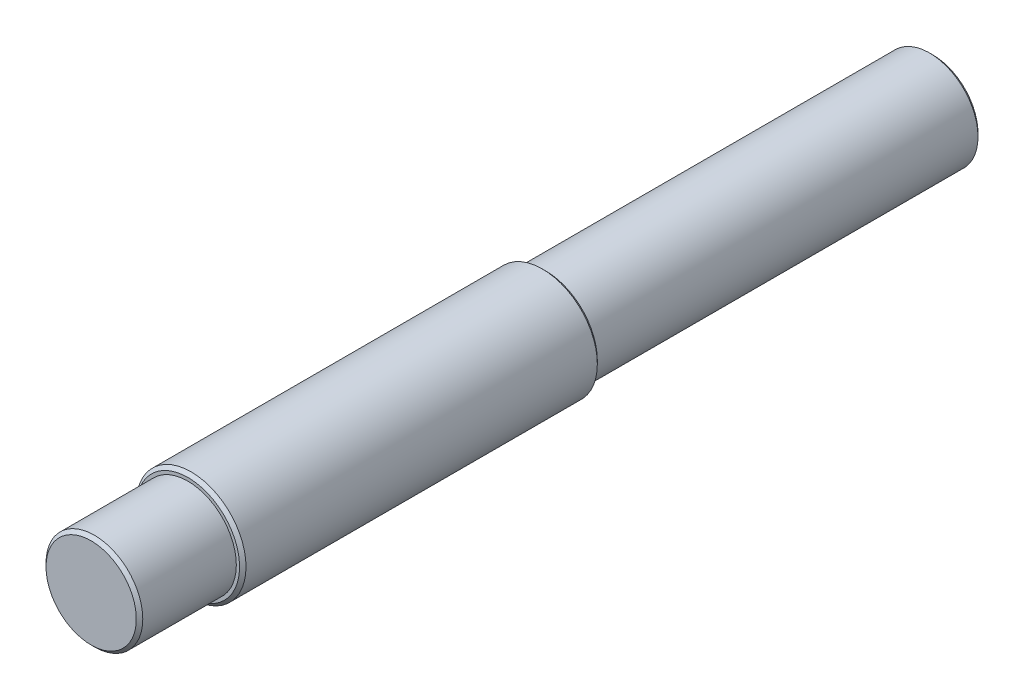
SolidWorks part; units mm, degrees
ref_plane "Спереди" through (0, 0, 0) normal (0, 0, 1) x (1, 0, 0)
ref_plane "Сверху" through (0, 0, 0) normal (0, 1, 0) x (1, 0, 0)
ref_plane "Справа" through (0, 0, 0) normal (1, 0, 0) x (0, 0, -1)
sketch "Эскиз1" plane through (0, 0, 0) normal (1, 0, 0) x (0, 0, -1)
  line L0 (-13.045, 0) -> (13.045, 0)
  line L1 (-13.045, 0) -> (-13.045, 1.5)
  line L2 (-13.045, 1.5) -> (-10.045, 1.5)
  line L3 (-10.045, 1.5) -> (-10.045, 1.7)
  line L4 (-10.045, 1.7) -> (1.045, 1.7)
  line L5 (1.045, 1.7) -> (1.045, 1.5)
  line L6 (1.045, 1.5) -> (13.045, 1.5)
  line L7 (13.045, 1.5) -> (13.045, 0)
  dimension "D1" = 1.5
  dimension "D2" = 1.7
  dimension "D3" = 3
  dimension "D4" = 12
  dimension "D5" = 11.09
revolve "Повернуть1" add sketch "Эскиз1" angle 360 about L0
chamfer "Фаска1" distance 0.1 angle 45 4 edges at (1.7, 0, -1.045) (1.7, 0, 10.045) (1.5, 0, -13.045) (1.5, 0, 13.045)
